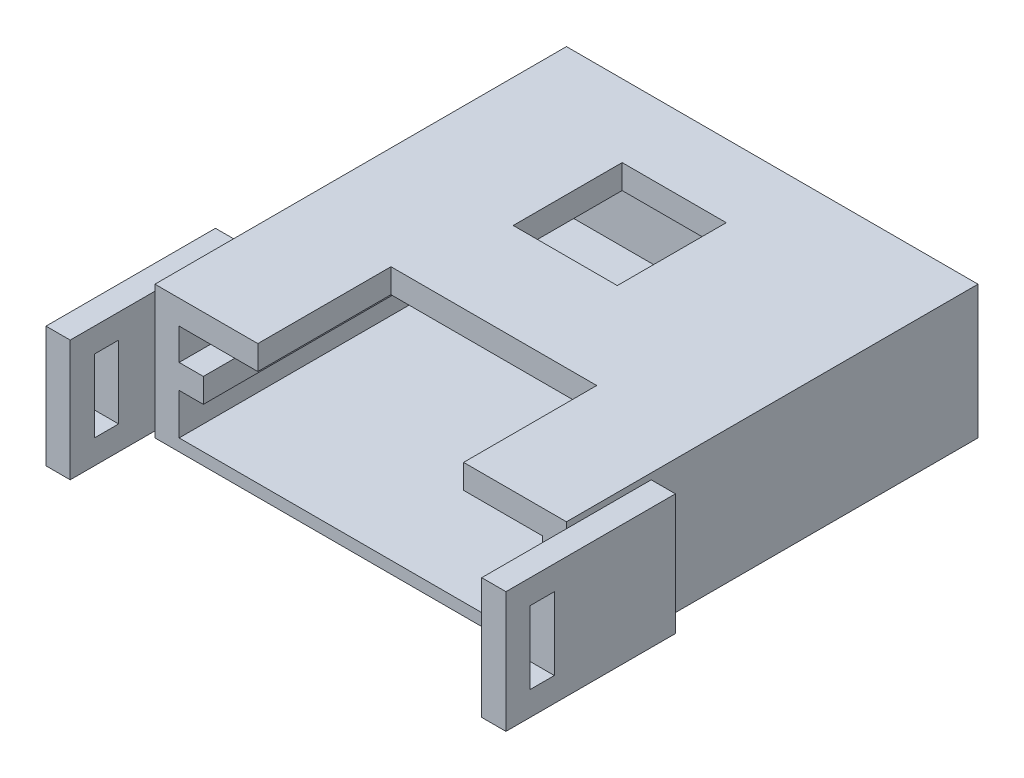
SolidWorks part; units mm, degrees
ref_plane "Front Plane" through (0, 0, 0) normal (0, 0, 1) x (1, 0, 0)
ref_plane "Top Plane" through (0, 0, 0) normal (0, 1, 0) x (1, 0, 0)
ref_plane "Right Plane" through (0, 0, 0) normal (1, 0, 0) x (0, 0, -1)
sketch "Sketch1" plane through (0, 0, 0) normal (0, 1, 0) x (1, 0, 0)
  line L1 (-7.5, -8) -> (7.5, -8)
  line L2 (-7.5, -8) -> (-7.5, 8)
  line L3 (-7.5, 8) -> (7.5, 8)
  line L4 (7.5, -8) -> (7.5, 8)
  line L5 (-7.5, -8) -> (7.5, 8) construction
  line L6 (-7.5, 8) -> (7.5, -8) construction
  point P0 (0, 0)
extrude "Boss-Extrude2" add sketch "Sketch1" along normal blind 0.5
sketch "Sketch2" plane through (0, 0, 0) normal (0, -1, 0) x (1, 0, 0)
  line L3 (8.5, 8) -> (7.5, 8)
  line L4 (7.5, 8) -> (7.5, -8)
  line L5 (7.5, -8) -> (-7.5, -8)
  line L6 (-8.5, -9) -> (-8.5, 8)
  line L7 (8.5, -9) -> (-8.5, -9)
  line L8 (8.5, 8) -> (8.5, -9)
  line L9 (-8.5, -9) -> (-8.5, 8)
  line L10 (8.5, -9) -> (-8.5, -9)
  line L11 (8.5, 8) -> (8.5, -9)
  line L12 (-7.5, -8) -> (-7.5, 8)
  line L13 (-7.5, 8) -> (-8.5, 8)
  dimension "D1" = 1
extrude "Boss-Extrude3" add sketch "Sketch2" against normal blind 5.5
sketch "Sketch3" plane through (0, 5.5, 0) normal (0, 1, 0) x (1, 0, 0)
  line L1 (8.5, -8) -> (-8.5, -8)
  line L2 (8.5, -8) -> (8.5, 9)
  line L3 (8.5, 9) -> (-8.5, 9)
  line L4 (-8.5, -8) -> (-8.5, 9)
extrude "Boss-Extrude4" add sketch "Sketch3" against normal blind 1
sketch "Sketch4" plane through (0, 5.5, 0) normal (0, 1, 0) x (1, 0, 0)
  line L0 (8.5, -8) -> (-8.5, -8) construction
  line L1 (-4.25, -13.5) -> (4.25, -13.5)
  line L2 (-4.25, -13.5) -> (-4.25, -2.5)
  line L3 (-4.25, -2.5) -> (4.25, -2.5)
  line L4 (4.25, -13.5) -> (4.25, -2.5)
  line L5 (-4.25, -13.5) -> (4.25, -2.5) construction
  line L6 (-4.25, -2.5) -> (4.25, -13.5) construction
  point P0 (0, -8)
extrude "Cut-Extrude1" cut sketch "Sketch4" against normal blind 1
sketch "Sketch5" plane through (0, 0, 8) normal (0, 0, 1) x (1, 0, 0)
  line L0 (-7.5, 4.5) -> (-7.5, 0.5) construction
  line L1 (-7.5, 3.2) -> (-6.5, 3.2)
  line L2 (-7.5, 3.2) -> (-7.5, 2.2)
  line L3 (-7.5, 2.2) -> (-6.5, 2.2)
  line L4 (-6.5, 3.2) -> (-6.5, 2.2)
  line L5 (-7.5, 0.5) -> (7.5, 0.5) construction
  line L6 (7.5, 4.5) -> (7.5, 0.5) construction
  line L7 (6.5, 3.2) -> (7.5, 3.2)
  line L8 (6.5, 3.2) -> (6.5, 2.2)
  line L9 (6.5, 2.2) -> (7.5, 2.2)
  line L10 (7.5, 3.2) -> (7.5, 2.2)
  dimension "D1" = 1.7
extrude "Boss-Extrude5" add sketch "Sketch5" against normal blind 17
sketch "Sketch6" plane through (0, 5.5, 0) normal (0, 1, 0) x (1, 0, 0)
  line L0 (-8.5, 9) -> (8.5, 9) construction
  line L1 (-3.2, 6) -> (1.1, 6)
  line L2 (-3.2, 6) -> (-3.2, 1.5)
  line L3 (-3.2, 1.5) -> (1.1, 1.5)
  line L4 (1.1, 6) -> (1.1, 1.5)
  line L6 (-8.5, -8) -> (-8.5, 9) construction
  point P4 (-1.05, 6)
  dimension "D1" = 3
  dimension "D2" = 5.3
extrude "Cut-Extrude2" cut sketch "Sketch6" against normal blind 1
sketch "Sketch7" plane through (8.5, 0, 0) normal (1, 0, 0) x (0, 0, -1)
  line L0 (-8, 5.5) -> (-8, 0) construction
  line L1 (-11.5, 0.25) -> (-4.5, 0.25)
  line L2 (-11.5, 0.25) -> (-11.5, 5.25)
  line L3 (-11.5, 5.25) -> (-4.5, 5.25)
  line L4 (-4.5, 0.25) -> (-4.5, 5.25)
  line L5 (-11.5, 0.25) -> (-4.5, 5.25) construction
  line L6 (-11.5, 5.25) -> (-4.5, 0.25) construction
  line L8 (-10.5, 1.25) -> (-9.5, 1.25)
  line L9 (-10.5, 1.25) -> (-10.5, 4.25)
  line L10 (-10.5, 4.25) -> (-9.5, 4.25)
  line L11 (-9.5, 1.25) -> (-9.5, 4.25)
  line L12 (-10.5, 1.25) -> (-9.5, 4.25) construction
  line L13 (-10.5, 4.25) -> (-9.5, 1.25) construction
  point P0 (-8, 2.75)
  point P7 (-10, 2.75)
  dimension "D1" = 1
  dimension "D2" = 1
  dimension "D3" = 1
extrude "Boss-Extrude6" add sketch "Sketch7" along normal blind 1
sketch "Sketch8" plane through (-8.5, 0, 0) normal (-1, 0, 0) x (0, 0, 1)
  line L0 (8, 5.25) -> (8, 0.25) construction
  line L1 (4.5, 0.25) -> (11.5, 0.25)
  line L2 (4.5, 0.25) -> (4.5, 5.25)
  line L3 (4.5, 5.25) -> (11.5, 5.25)
  line L4 (11.5, 0.25) -> (11.5, 5.25)
  line L5 (4.5, 0.25) -> (11.5, 5.25) construction
  line L6 (4.5, 5.25) -> (11.5, 0.25) construction
  line L7 (11.5, 5.25) -> (11.5, 0.25) construction
  line L9 (10.5, 4.25) -> (9.5, 4.25)
  line L10 (10.5, 4.25) -> (10.5, 1.25)
  line L11 (10.5, 1.25) -> (9.5, 1.25)
  line L12 (9.5, 4.25) -> (9.5, 1.25)
  point P0 (8, 2.75)
extrude "Boss-Extrude7" add sketch "Sketch8" along normal blind 1
